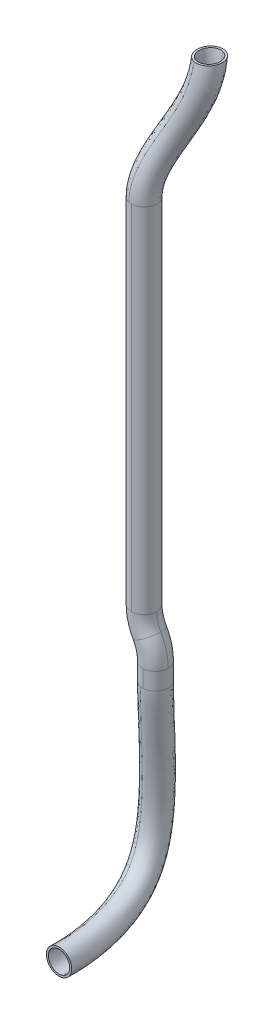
SolidWorks part; units mm, degrees
ref_plane "前视基准面" through (0, 0, 0) normal (0, 0, 1) x (1, 0, 0)
ref_plane "上视基准面" through (0, 0, 0) normal (0, 1, 0) x (1, 0, 0)
ref_plane "右视基准面" through (0, 0, 0) normal (1, 0, 0) x (0, 0, -1)
imported_body "输入1"
split "分割1" trim tools "前视基准面" bodies to split 106 resulting bodies 110
sketch "草图3" plane through (0, 0, 0) normal (0, 0, 1) x (1, 0, 0)
  line L0 (133.1467, 1336.5039) -> (299.9785, 1344.2635)
ref_plane "基准面1" through (-61.7414, 1327.4393, 0) normal (0.0465, -0.9989, 0) x (0.9989, 0.0465, 0)
split "分割2" trim tools "基准面1" bodies to split 110 108 resulting bodies 111
